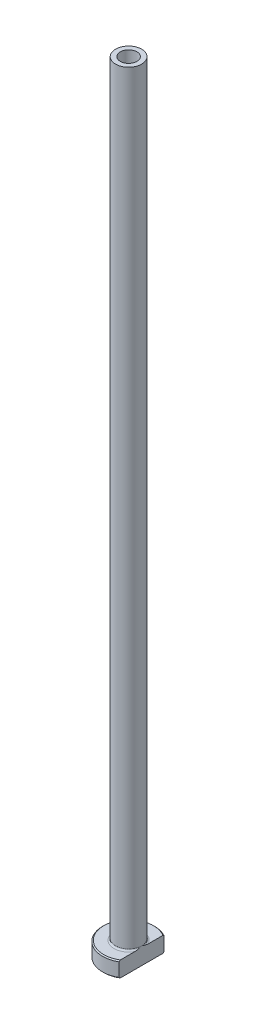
SolidWorks part; units mm, degrees
ref_plane "Front Plane" through (0, 0, 0) normal (0, 0, 1) x (1, 0, 0)
ref_plane "Top Plane" through (0, 0, 0) normal (0, 1, 0) x (1, 0, 0)
ref_plane "Right Plane" through (0, 0, 0) normal (1, 0, 0) x (0, 0, -1)
sketch "Sketch1" plane through (0, 0, 0) normal (0, 0, 1) x (1, 0, 0)
  line L0 (-1.6, 150) -> (-2.5, 150)
  line L1 (-2.5, 150) -> (-2.5, 3)
  line L2 (-2.5, 3) -> (-5, 3)
  line L3 (-5, 3) -> (-5, 0)
  line L4 (4.125, 0) -> (-4.125, 0) construction
  line L5 (-5, 0) -> (-1.85, 0)
  line L6 (-1.6, 105) -> (-1.6, 150)
  line L7 (0, 92.1877) -> (0, -15.5353) construction
  line L8 (0, -5.5) -> (0, 5.5) construction
  line L9 (-1.6, 105) -> (-1.85, 93)
  line L10 (-1.85, 93) -> (-1.85, 0)
  dimension "D1" = 0.25
  dimension "ID" = 3.2
  dimension "OD" = 5
  dimension "L" = 150
  dimension "H" = 10
  dimension "T" = 3
  dimension "N" = 45
  dimension "D2" = 12
  dimension "L-N" = 105
revolve "Revolve1" add sketch "Sketch1" angle 360 about L7
fillet "Fillet1" radius 0.3 1 edges at (0, 3, 2.5)
chamfer "Chamfer1" distance 0.2 angle 45 2 edges at (0, 3, 5) (0, 0, 5)
sketch "Sketch2" plane through (0, 0, 0) normal (0, -1, 0) x (1, 0, 0)
  line L0 (2.5, 4.3301) -> (2.5, -4.3301)
  circle A0 centre (0, 0) radius 5 construction
  arc A1 (2.5, 4.3301) -> (2.5, -4.3301) centre (0, 0) cw
  circle A2 centre (0, 0) radius 2.5 construction
extrude "Cut-Extrude1" cut sketch "Sketch2" against normal through all
chamfer "Chamfer2" distance 0.5 angle 45 1 edges at (0, 0, 1.85)
